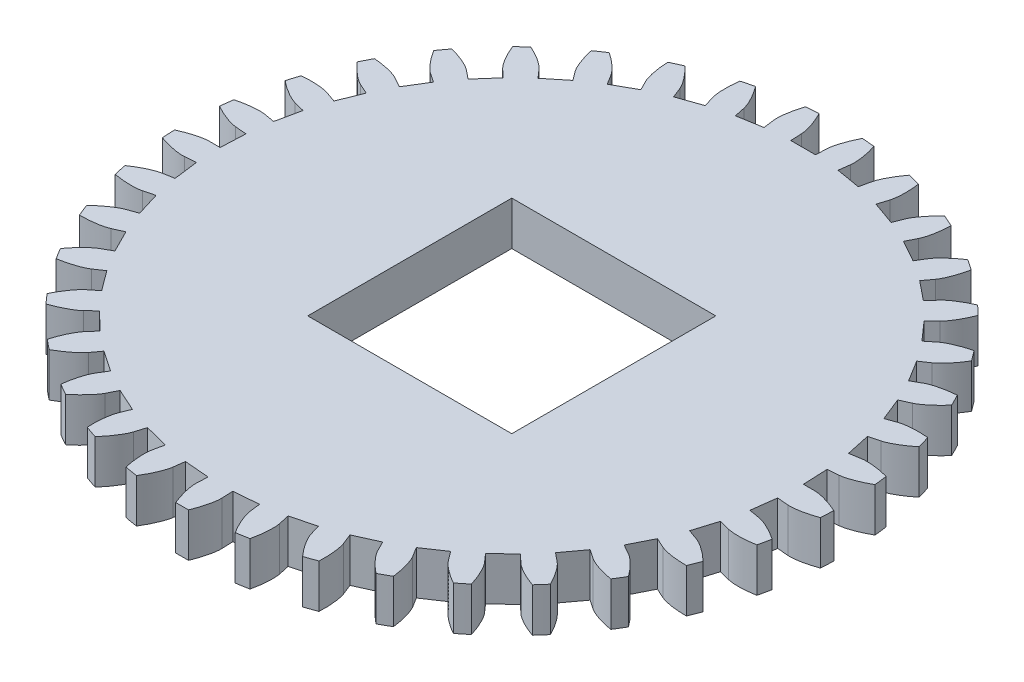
SolidWorks part; units mm, degrees
ref_plane "Front Plane" through (0, 0, 0) normal (0, 0, 1) x (1, 0, 0)
ref_plane "Top Plane" through (0, 0, 0) normal (0, 1, 0) x (1, 0, 0)
ref_plane "Right Plane" through (0, 0, 0) normal (1, 0, 0) x (0, 0, -1)
sketch "Sketch1" plane through (0, 0, 0) normal (0, 1, 0) x (1, 0, 0)
  line L0 (0, 0) -> (0, 10.3882) construction
  line L1 (0, 0) -> (-10.3882, 0) construction
  line L2 (0, 0) -> (-11.2998, -0.48) construction
  line L3 (0, 0) -> (-10.3508, -0.881) construction
  line L4 (0, 0) -> (-10.2388, -1.7556) construction
  circle A0 centre (0, 0) radius 10.73 construction
  circle A1 centre (0, 0) radius 10.3882 construction
  circle A2 centre (0, 0) radius 10.005 construction
  circle A3 centre (0, 0) radius 11.31 construction
  spline S0 degree 4 poles (-10.3882, 0) (-10.4046, 0) (-10.4504, -0.0017) (-10.5366, -0.0115) (-10.676, -0.0368) (-10.851, -0.0827) (-11.073, -0.1574) (-11.3279, -0.2646) (-11.5999, -0.4023) (-11.8855, -0.5725) (-12.1603, -0.7601) (-12.4242, -0.9628) (-12.6772, -1.1789) (-12.971, -1.4557) (-13.3054, -1.8099) (-13.6676, -2.2506) (-14.0432, -2.7854) (-14.3855, -3.3564) (-14.6885, -3.949) (-14.953, -4.56) (-15.1517, -5.1071) (-15.2992, -5.5844) (-15.4287, -6.0652) (-15.522, -6.4724) (-15.6007, -6.8773) (-15.6656, -7.293) (-15.7087, -7.6142) (-15.7443, -7.9608) (-15.7704, -8.264) (-15.7945, -8.7119) (-15.8014, -8.9809) (-15.8052, -9.4109) (-15.797, -9.6182) (-15.7936, -9.7968) (-15.7901, -9.845) (-15.7888, -9.8846) knots 0 0 0 0 0 0.005377 0.015084 0.028532 0.04661 0.064855 0.092111 0.119476 0.146842 0.174209 0.201575 0.228941 0.256307 0.307035 0.361767 0.4165 0.471232 0.525964 0.580697 0.635429 0.662795 0.690161 0.744894 0.77226 0.799626 0.826992 0.854358 0.881725 0.909091 0.954545 0.977273 0.988636 1 1 1 1 1 construction
  spline S1 degree 4 poles (-10.3882, 0) (-10.4046, 0) (-10.4504, -0.0017) (-10.5366, -0.0115) (-10.676, -0.0368) (-10.851, -0.0827) (-11.073, -0.1574) (-11.3279, -0.2646) (-11.5999, -0.4023) (-11.8855, -0.5725) (-12.1603, -0.7601) (-12.4242, -0.9628) (-12.6772, -1.1789) (-12.971, -1.4557) (-13.3054, -1.8099) (-13.6676, -2.2506) (-14.0432, -2.7854) (-14.3855, -3.3564) (-14.6885, -3.949) (-14.953, -4.56) (-15.1517, -5.1071) (-15.2992, -5.5844) (-15.4287, -6.0652) (-15.522, -6.4724) (-15.6007, -6.8773) (-15.6656, -7.293) (-15.7087, -7.6142) (-15.7443, -7.9608) (-15.7704, -8.264) (-15.7859, -8.5523) (-15.7923, -8.7049) (-15.7948, -8.7805) knots 0 0 0 0 0 0.005377 0.015084 0.028532 0.04661 0.064855 0.092111 0.119476 0.146842 0.174209 0.201575 0.228941 0.256307 0.307035 0.361767 0.4165 0.471232 0.525964 0.580697 0.635429 0.662795 0.690161 0.744894 0.77226 0.799626 0.826992 0.854358 0.881725 0.909091 0.909091 0.909091 0.909091 0.909091
  dimension "D1" = 22.62
  dimension "D2" = 21.46
  dimension "D3" = 20.7764
  dimension "D4" = 20.01
  dimension "D5" = 10.3882
  dimension "D6" = 2.432
  dimension "D7" = 4.865
  dimension "D8" = 9.73
sketch "Sketch2" plane through (0, 0, 0) normal (0, 1, 0) x (1, 0, 0)
  line L0 (0, 0) -> (-11.2998, -0.48) construction
  line L1 (0, 0) -> (-11.2998, -0.48) construction
  line L2 (0, 0) -> (-10.3508, -0.881) construction
  line L3 (0, 0) -> (-10.3882, 0) construction
  line L4 (0, 0) -> (-10.2388, -1.7556) construction
  line L5 (0, 0) -> (-10.3508, -0.881) construction
  line L6 (0, 0) -> (-10.3882, 0) construction
  line L7 (0, 0) -> (-10.2388, -1.7556) construction
  line L8 (-10.3508, -0.881) -> (-9.969, -0.8485)
  line L9 (-9.969, -0.8485) -> (-9.8611, -1.6909)
  line L10 (-9.8611, -1.6909) -> (-10.2388, -1.7556) construction
  line L11 (-9.8611, -1.6909) -> (-1.4784, -0.2535)
  line L12 (-10.3882, 0) -> (-1.5, 0)
  circle A0 centre (0, 0) radius 10.005 construction
  circle A1 centre (0, 0) radius 10.3882 construction
  circle A2 centre (0, 0) radius 10.73 construction
  circle A3 centre (0, 0) radius 11.31 construction
  circle A4 centre (0, 0) radius 10.005 construction
  circle A5 centre (0, 0) radius 10.3882 construction
  circle A6 centre (0, 0) radius 10.73 construction
  circle A7 centre (0, 0) radius 11.31 construction
  arc A8 (-11.2883, -0.7) -> (-11.307, -0.2599) centre (0, 0) cw
  circle A11 centre (0, 0) radius 1.5 construction
  arc A12 (-1.5, 0) -> (-1.4784, -0.2535) centre (0, 0) ccw
  spline S0 degree 4 poles (-39.3814, -999.5783) (-7.8171, -22.9083) (-8.3963, -0.5022) (-9.5783, 0.1628) (-10.676, -0.0368) (-10.851, -0.0827) (-11.073, -0.1574) (-11.3279, -0.2646) (-11.5999, -0.4023) (-11.8855, -0.5725) (-12.1603, -0.7601) (-12.4242, -0.9628) (-12.6772, -1.1789) (-12.971, -1.4557) (-13.3054, -1.8099) (-13.6676, -2.2506) (-14.0432, -2.7854) (-14.3855, -3.3564) (-14.6885, -3.949) (-14.953, -4.56) (-15.1517, -5.1071) (-15.2992, -5.5844) (-15.4287, -6.0652) (-15.522, -6.4724) (-15.6007, -6.8773) (-15.6656, -7.293) (-15.7087, -7.6142) (-15.7443, -7.9608) (-15.8677, -9.398) (-15.841, -12.9421) (-14.3604, 22.3985) (-48.2201, -1008.2245) knots -0.320432 -0.320432 -0.320432 -0.320432 -0.320432 0.005377 0.015084 0.028532 0.04661 0.064855 0.092111 0.119476 0.146842 0.174209 0.201575 0.228941 0.256307 0.307035 0.361767 0.4165 0.471232 0.525964 0.580697 0.635429 0.662795 0.690161 0.744894 0.77226 0.799626 0.826992 0.854358 0.881725 1.318475 1.318475 1.318475 1.318475 1.318475 only from (-10.3882, 0) to (-15.7948, -8.7805) construction
  spline S1 degree 4 poles (-10.3882, 0) (-10.4046, 0) (-10.4504, -0.0017) (-10.5366, -0.0115) (-10.676, -0.0368) (-10.851, -0.0827) (-11.0353, -0.1447) (-11.1777, -0.2021) (-11.2678, -0.2419) (-11.307, -0.2599) knots 0 0 0 0 0 0.005377 0.015084 0.028532 0.04661 0.064855 0.079037 0.079037 0.079037 0.079037 0.079037
  spline S2 degree 4 poles (-10.3508, -0.881) (-10.3671, -0.8824) (-10.4129, -0.8846) (-10.4996, -0.8821) (-10.6407, -0.8687) (-10.819, -0.8378) (-11.0078, -0.7917) (-11.1546, -0.7466) (-11.2478, -0.7145) (-11.2883, -0.7) knots 0 0 0 0 0 0.005377 0.015084 0.028532 0.04661 0.064855 0.079037 0.079037 0.079037 0.079037 0.079037
  point P21 (-9.969, -0.8485)
  point P24 (-9.8611, -1.6909)
  dimension "D2" = 3
extrude "Boss-Extrude1" add sketch "Sketch2" along normal blind 1.5
pattern_circular "CirPattern1" count 37 over 360 of "Boss-Extrude1"
sketch "Sketch3" plane through (0, 1.5, 0) normal (0, 1, 0) x (1, 0, 0)
  line L1 (-3.5, -3.5) -> (3.5, -3.5)
  line L2 (-3.5, -3.5) -> (-3.5, 3.5)
  line L3 (-3.5, 3.5) -> (3.5, 3.5)
  line L4 (3.5, -3.5) -> (3.5, 3.5)
  line L5 (-3.5, -3.5) -> (3.5, 3.5) construction
  line L6 (-3.5, 3.5) -> (3.5, -3.5) construction
  point P0 (0, 0)
  dimension "D1" = 7
extrude "Cut-Extrude1" cut sketch "Sketch3" against normal up to surface (1.5 mm away)
sketch "Sketch4" plane through (0, 1.5, 0) normal (0, 1, 0) x (1, 0, 0)
  circle A0 centre (0, 0) radius 6
  dimension "D1" = 12
equation "\"Module\" = .58"
equation "\"Number of Teeth\"= 37"
equation "\"Pressure Angle\"= 14.5deg"
equation "\"Pitch Diameter\"= \"Number of Teeth\" * \"Module\""
equation "\"Circular Pitch\"= pi * \"Module\""
equation "\"Addendum\"= \"Module\""
equation "\"Dedendum\"= 1.25 * \"Module\""
equation "\"Base Diameter\"= \"Pitch Diameter\" * cos ( \"Pressure Angle\" )"
equation "\"Base Radius\"= \"Base Diameter\" / 2"
equation "\"Width\"= 1.5"
equation "\"Outside Diameter\"= \"Pitch Diameter\" + 2 * \"Addendum\""
equation "\"D1@Sketch1\"=\"Outside Diameter\""
equation "\"D3@Sketch1\"=\"Base Diameter\""
equation "\"Root Diameter\"= \"Pitch Diameter\" - 2 * \"Dedendum\""
equation "\"D4@Sketch1\"=\"Root Diameter\""
equation "\"Tooth Angle\"= 360 / \"Number of Teeth\""
equation "\"D6@Sketch1\"=\"Tooth Angle\"/4"
equation "\"D7@Sketch1\"=\"Tooth Angle\"/2"
equation "\"D8@Sketch1\"=\"Tooth Angle\""
equation "\"D2@Sketch1\" = \"Pitch Diameter\""
equation "\"Shaft Diameter\"= 3"
equation "\"D1@CirPattern1\" = \"Number of Teeth\""
equation "\"D2@Sketch2\"= \"Shaft Diameter\""
equation "\"D1@Boss-Extrude1\" = \"Width\""
